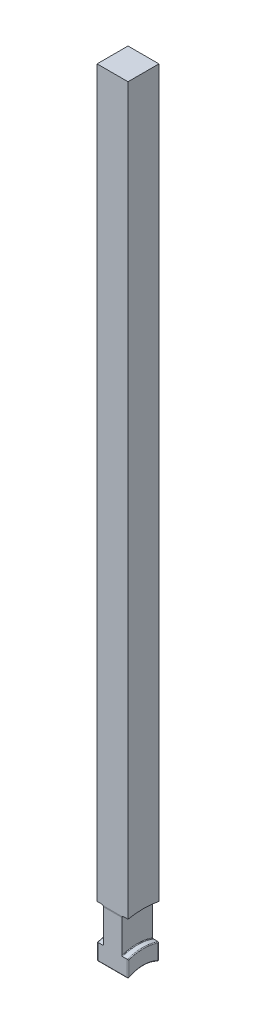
SolidWorks part; units mm, degrees
other "<6-40 DETENT>-<Imported1>"
other "<6-40 DETENT>-<Imported2>"
ref_plane "Front Plane" through (0, 0, 0) normal (0, 0, 1) x (1, 0, 0)
ref_plane "Top Plane" through (0, 0, 0) normal (0, 1, 0) x (1, 0, 0)
ref_plane "Right Plane" through (0, 0, 0) normal (1, 0, 0) x (0, 0, -1)
sketch "Sketch1" plane through (0, 0, 0) normal (1, 0, 0) x (0, 0, -1)
  line L0 (-5, 260) -> (-5, 0)
  line L1 (0, 249.2329) -> (0, 0) construction
  line L2 (5, 260) -> (5, 0)
  line L3 (-5, 260) -> (5, 260)
  line L4 (-5, 0) -> (5, 0)
  circle A1 centre (0, 0) radius 10 construction
  point P5 (0, 9.5428)
  dimension "D1" = 10
  dimension "D2" = 250
  dimension "D3" = 10
  dimension "D4" = 0.4572
extrude "Boss-Extrude1" add sketch "Sketch1" along normal mid plane 10
sketch "Sketch2" plane through (0, 0, 0) normal (0, 0, 1) x (1, 0, 0)
  line L0 (5, 15) -> (3, 15)
  line L1 (5, 260) -> (5, 0) construction
  line L2 (3, 15) -> (3, 26)
  line L3 (3, 26) -> (5, 26)
  line L4 (5, 26) -> (5, 15)
  line L5 (0, 29.9173) -> (0, 0) construction
  line L6 (-5, 26) -> (-5, 15)
  line L7 (-3, 26) -> (-5, 26)
  line L8 (-3, 15) -> (-3, 26)
  line L9 (-5, 15) -> (-3, 15)
  line L10 (-8.8482, 0) -> (24.5305, 0) construction
  dimension "D1" = 6
  dimension "D2" = 26
  dimension "D3" = 15
revolve "Cut-Revolve1" cut sketch "Sketch2" angle 360 about L10
sketch "Sketch6" plane through (0, 0, 0) normal (1, 0, 0) x (0, 0, -1)
  line L0 (0, 19.903) -> (0, 3.2785) construction
  line L1 (4.975, 0) -> (20.215, 0)
  line L2 (4.975, 0) -> (4.975, 25)
  line L3 (6.975, 27) -> (20.215, 27)
  line L4 (20.215, 0) -> (20.215, 27)
  line L9 (-4.975, 0) -> (-20.215, 0)
  line L10 (-20.215, 0) -> (-20.215, 27)
  line L11 (-6.975, 27) -> (-20.215, 27)
  line L12 (-4.975, 0) -> (-4.975, 25)
  line L13 (-5, 0) -> (5, 0) construction
  line L14 (-5, 22.1375) -> (-5, 27) construction
  line L15 (-5, 260) -> (-5, 25.5147) construction
  arc A0 (4.975, 25) -> (6.975, 27) centre (6.975, 25) cw
  arc A1 (-4.975, 25) -> (-6.975, 27) centre (-6.975, 25) ccw
  dimension "D3" = 2
  dimension "D1" = 9.95
  dimension "D2" = 15.24
  dimension "D4" = 27
extrude "Cut-Extrude2" cut sketch "Sketch6" against normal through all both and the other way through all
sketch "Sketch7" plane through (0, 0, 0) normal (1, 0, 0) x (0, 0, -1)
  circle A0 centre (0, 0) radius 10
  dimension "D1" = 10
extrude "Cut-Extrude3" cut sketch "Sketch7" against normal through all both and the other way through all
sketch "Sketch8" plane through (0, 0, 0) normal (0, 0, 1) x (1, 0, 0)
  line L1 (-5, 15) -> (-4.975, 15)
  line L2 (-5, 15) -> (-5, 8.6746)
  line L3 (-5, 8.6746) -> (-4.975, 8.6746)
  line L4 (-4.975, 15) -> (-4.975, 8.6746)
  line L5 (0, 18.3159) -> (0, 0) construction
  line L6 (4.975, 15) -> (4.975, 8.6746)
  line L7 (5, 8.6746) -> (4.975, 8.6746)
  line L8 (5, 15) -> (5, 8.6746)
  line L9 (5, 15) -> (4.975, 15)
  line L10 (-5, 8.6746) -> (5, 8.6746) construction
  dimension "D1" = 9.95
extrude "Cut-Extrude4" cut sketch "Sketch8" against normal through all both and the other way through all
fillet "Fillet1" radius 0.5 2 edges at (-3, 26, 0) (3, 26, 0)
fillet "Fillet2" radius 0.2 2 edges at (-3, 15, 0) (3, 15, 0)
hole_wizard "#6-40 Tapped Hole1" positions "Sketch3" profile "Sketch4" tap size "#6-40" standard "ANSI Inch"
sketch "Sketch3" plane through (0, 0, 0) normal (0, 1, 0) x (1, 0, 0)
  point P0 (0, 0)
sketch "Sketch4" plane through (0, 0, 0) normal (1, 0, 0) x (0, 0, -1)
  line L0 (0, 0) -> (0, 20.8623)
  line L1 (0, 20.8623) -> (1.4351, 20)
  line L2 (1.4351, 20) -> (1.4351, 0)
  line L5 (1.4351, 0) -> (0, 0)
  line L10 (0, 20.8623) -> (-1.4351, 20) construction
  line L11 (0, -6.35) -> (0, 107.95) construction
  dimension "Tap Drill Dia." = 2.8702
  dimension "Tap Drill Depth" = 20
  dimension "Drill Angle" = 118
fillet "Fillet3" radius 0.25 10 edges at (0, 8.6746, -4.975) (-4.975, 10, 0) (4.975, 10, 0) (0, 8.6746, 4.975) (-4.975, 11.4128, 4.975) (-4.975, 15, 0) (-4.975, 11.4128, -4.975) (4.975, 11.4128, -4.975) (4.975, 15, 0) (4.975, 11.4128, 4.975)
ref_plane "Detent Plane" through (0, 9.5428, 0) normal (0, 1, 0) x (1, 0, 0)
inserted part "6-40 DETENT"
move or copy body "Body-Move/Copy2" placed by mates yes
